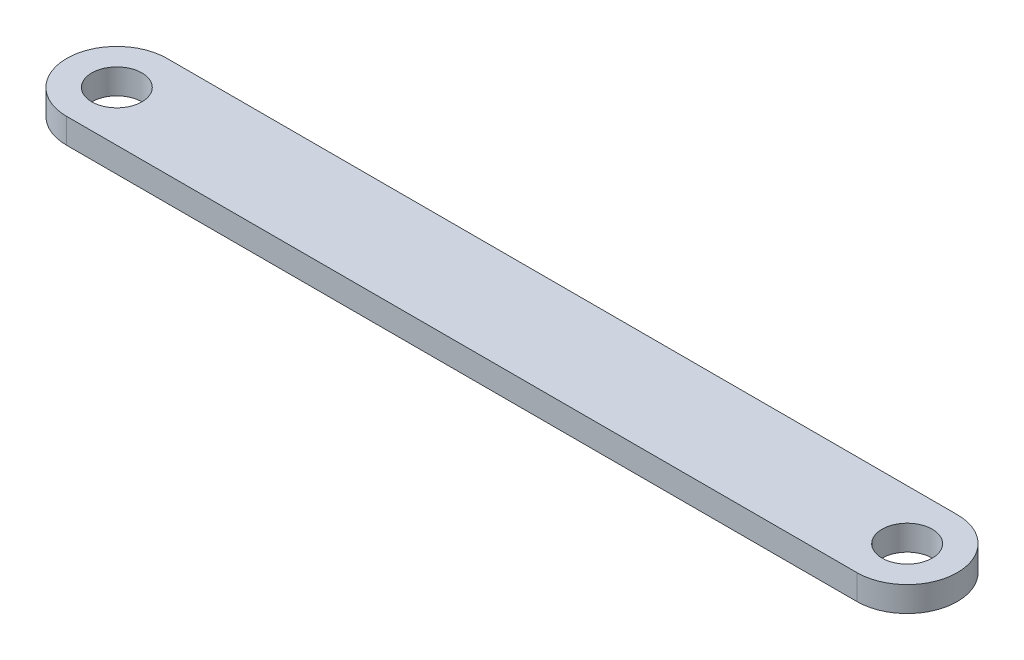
SolidWorks part; units mm, degrees
ref_plane "Front Plane" through (0, 0, 0) normal (0, 0, 1) x (1, 0, 0)
ref_plane "Top Plane" through (0, 0, 0) normal (0, 1, 0) x (1, 0, 0)
ref_plane "Right Plane" through (0, 0, 0) normal (1, 0, 0) x (0, 0, -1)
sketch "Sketch1" plane through (0, 0, 0) normal (0, 1, 0) x (1, 0, 0)
  line L0 (0, 0) -> (100, 0) construction
  line L1 (0, 6.35) -> (100, 6.35)
  line L2 (0, -6.35) -> (100, -6.35)
  circle A0 centre (0, 0) radius 3.175
  arc A1 (0, 6.35) -> (0, -6.35) centre (0, 0) ccw
  arc A2 (100, -6.35) -> (100, 6.35) centre (100, 0) ccw
  circle A3 centre (100, 0) radius 3.175
  point P4 (50, 0)
  dimension "D1" = 6.35
  dimension "D2" = 6.35
  dimension "D4" = 6.35
  dimension "D3" = 100
extrude "Boss-Extrude1" add sketch "Sketch1" along normal blind 3.175
